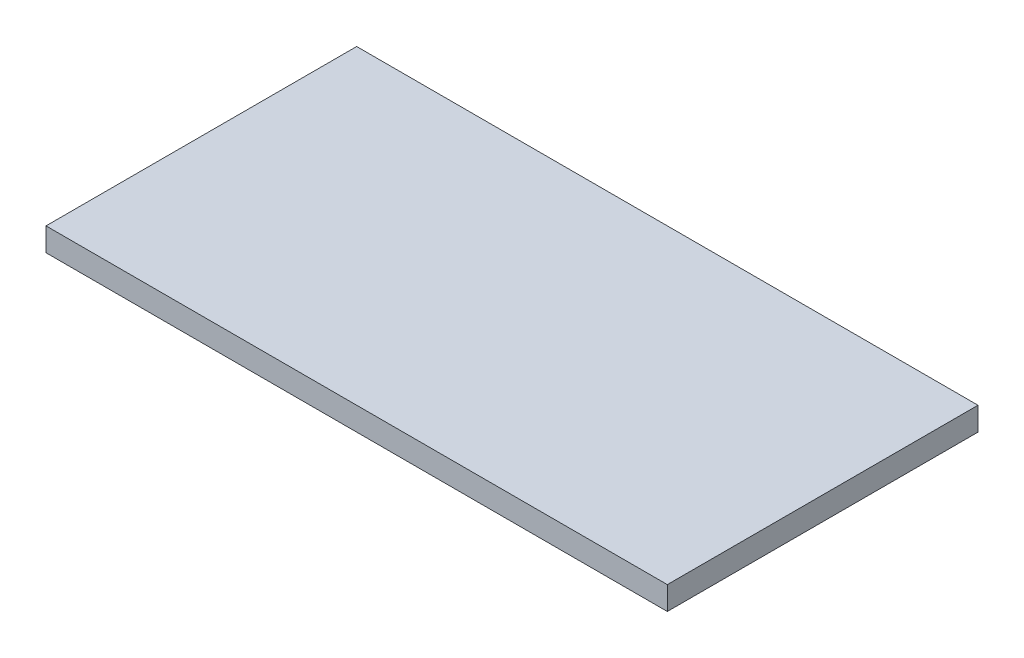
SolidWorks part; units mm, degrees
ref_plane "Front Plane" through (0, 0, 0) normal (0, 0, 1) x (1, 0, 0)
ref_plane "Top Plane" through (0, 0, 0) normal (0, 1, 0) x (1, 0, 0)
ref_plane "Right Plane" through (0, 0, 0) normal (1, 0, 0) x (0, 0, -1)
sketch "Sketch1" plane through (0, 0, 0) normal (0, 1, 0) x (1, 0, 0)
  line L1 (-63.5, -31.75) -> (63.5, -31.75)
  line L2 (-63.5, -31.75) -> (-63.5, 31.75)
  line L3 (-63.5, 31.75) -> (63.5, 31.75)
  line L4 (63.5, -31.75) -> (63.5, 31.75)
  line L5 (-63.5, -31.75) -> (63.5, 31.75) construction
  line L6 (-63.5, 31.75) -> (63.5, -31.75) construction
  point P0 (0, 0)
  dimension "D1" = 127
  dimension "D2" = 63.5
extrude "Boss-Extrude1" add sketch "Sketch1" along normal blind 4.7625
